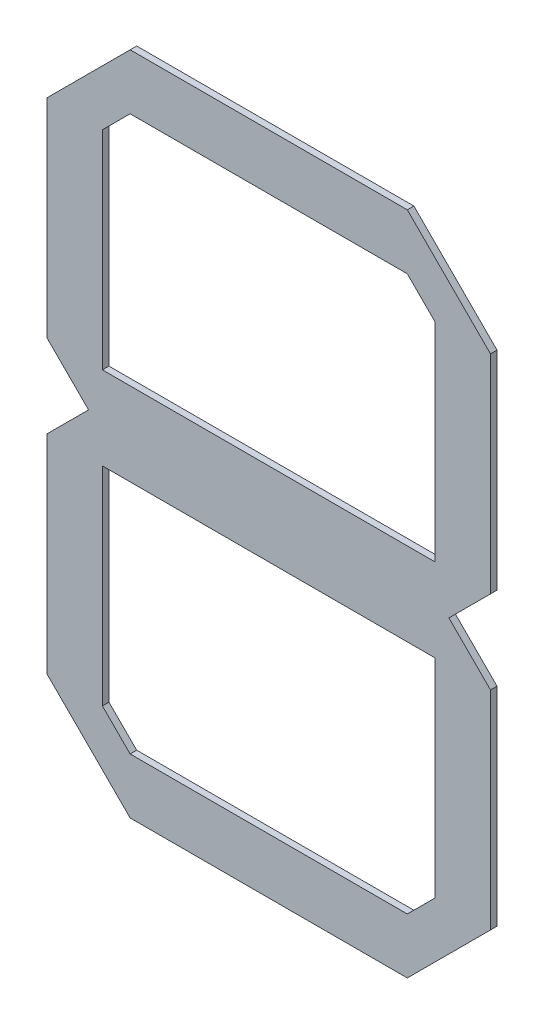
SolidWorks part; units mm, degrees
ref_plane "Front Plane" through (0, 0, 0) normal (0, 0, 1) x (1, 0, 0)
ref_plane "Top Plane" through (0, 0, 0) normal (0, 1, 0) x (1, 0, 0)
ref_plane "Right Plane" through (0, 0, 0) normal (1, 0, 0) x (0, 0, -1)
sketch "Sketch1" plane through (0, 0, 0) normal (0, 0, 1) x (1, 0, 0)
  line L0 (203.2, 304.8) -> (203.2, 340.5856) construction
  line L1 (-203.2, 38.1) -> (-203.2, 228.6)
  line L2 (203.2, 228.6) -> (203.2, 38.1)
  line L3 (203.2, -38.1) -> (203.2, -228.6)
  line L4 (127, -304.8) -> (-127, -304.8)
  line L5 (-203.2, -228.6) -> (-203.2, -38.1)
  line L6 (-127, 304.8) -> (127, 304.8)
  line L7 (203.2, 340.5856) -> (127, 340.5856) construction
  line L8 (203.2, 304.8) -> (239.4983, 304.8) construction
  line L9 (239.4983, 304.8) -> (239.4983, 228.6) construction
  line L10 (203.2, 228.6) -> (127, 304.8)
  line L11 (-203.2, 133.35) -> (-152.4, 133.35) construction
  line L12 (0, 304.8) -> (0, 254) construction
  line L13 (-203.2, 228.6) -> (-127, 304.8)
  line L14 (203.2, -228.6) -> (127, -304.8)
  line L15 (-203.2, -228.6) -> (-127, -304.8)
  line L16 (203.2, 133.35) -> (152.4, 133.35) construction
  line L17 (-165.1, 0) -> (-203.2, -38.1)
  line L18 (-165.1, 0) -> (-203.2, 38.1)
  line L19 (165.1, 0) -> (203.2, -38.1)
  line L20 (165.1, 0) -> (203.2, 38.1)
  line L21 (-152.4, 38.1) -> (-152.4, 228.6)
  line L22 (-152.4, 228.6) -> (-127, 254)
  line L23 (-127, 254) -> (0, 254)
  line L24 (0, 254) -> (127, 254)
  line L25 (127, 254) -> (152.4, 228.6)
  line L26 (152.4, 228.6) -> (152.4, 38.1)
  line L27 (0, 0) -> (-69.8265, 0) construction
  line L28 (127, -254) -> (152.4, -228.6)
  line L29 (152.4, -228.6) -> (152.4, -38.1)
  line L30 (0, -254) -> (127, -254)
  line L31 (-127, -254) -> (0, -254)
  line L32 (-152.4, -228.6) -> (-127, -254)
  line L33 (-152.4, -38.1) -> (-152.4, -228.6)
  line L34 (-152.4, -38.1) -> (152.4, -38.1)
  line L35 (-152.4, 38.1) -> (152.4, 38.1)
  dimension "D1" = 50.8
  dimension "D2" = 50.8
  dimension "D3" = 76.2
  dimension "D4" = 76.2
  dimension "D5" = 50.8
extrude "Boss-Extrude1" add sketch "Sketch1" against normal blind 6
